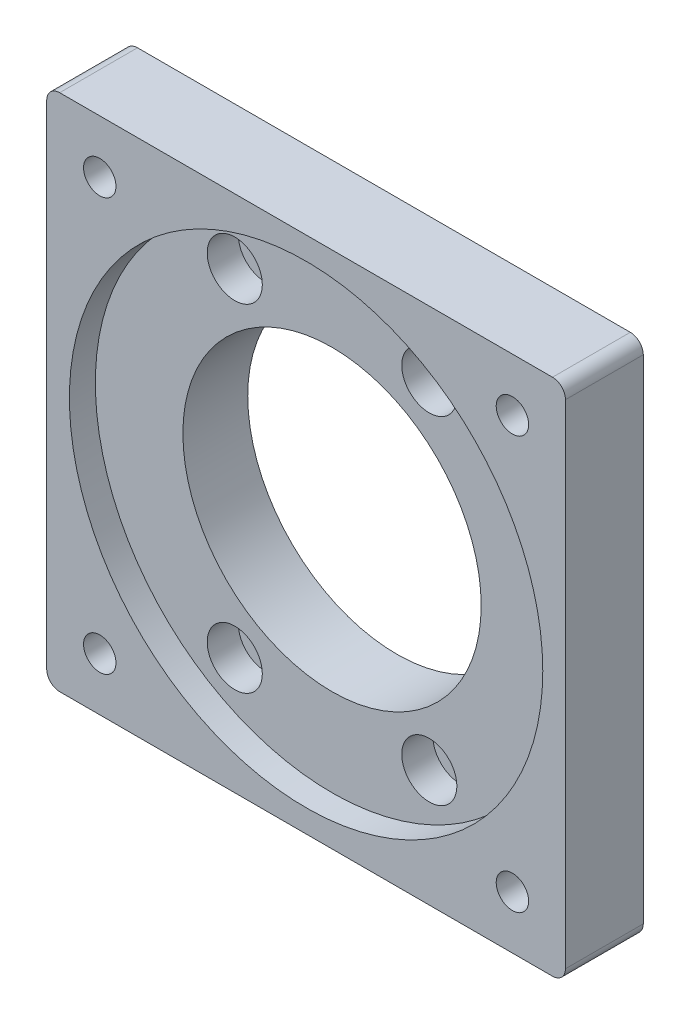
SolidWorks part; units mm, degrees
ref_plane "前视基准面" through (0, 0, 0) normal (0, 0, 1) x (1, 0, 0)
ref_plane "上视基准面" through (0, 0, 0) normal (0, 1, 0) x (1, 0, 0)
ref_plane "右视基准面" through (0, 0, 0) normal (1, 0, 0) x (0, 0, -1)
sketch "草图1" plane through (0, 0, 0) normal (0, 0, 1) x (1, 0, 0)
  line L1 (-40, -40) -> (40, -40)
  line L2 (-40, -40) -> (-40, 40)
  line L3 (-40, 40) -> (40, 40)
  line L4 (40, -40) -> (40, 40)
  line L5 (-40, -40) -> (40, 40) construction
  line L6 (-40, 40) -> (40, -40) construction
  circle A0 centre (0, 0) radius 23
  point P0 (0, 0)
  dimension "D3" = 46
  dimension "D1" = 80
  dimension "D2" = 80
extrude "凸台-拉伸1" add sketch "草图1" along normal blind 12
sketch "草图2" plane through (0, 0, 12) normal (0, 0, 1) x (1, 0, 0)
  line L0 (0, 40) -> (0, 0) construction
  line L1 (40, 40) -> (-40, 40) construction
  line L2 (0, 0) -> (-40, 0) construction
  line L3 (-40, 40) -> (-40, -40) construction
  line L4 (-31.8198, 31.8198) -> (31.8198, -31.8198) construction
  line L5 (31.8198, 31.8198) -> (-31.8198, -31.8198) construction
  circle A0 centre (-31.8198, 31.8198) radius 2.1
  circle A1 centre (31.8198, 31.8198) radius 2.1
  circle A2 centre (31.8198, -31.8198) radius 2.1
  circle A3 centre (-31.8198, -31.8198) radius 2.1
  circle A4 centre (0, 0) radius 45 construction
  dimension "D1" = 45
  dimension "D2" = 90
  dimension "D3" = 4.2
extrude "切除-拉伸1" cut sketch "草图2" against normal through all
sketch "草图3" plane through (0, 0, 12) normal (0, 0, 1) x (1, 0, 0)
  circle A0 centre (0, 0) radius 36.5
  dimension "D1" = 73
extrude "切除-拉伸2" cut sketch "草图3" against normal blind 4
sketch "草图5" plane through (0, 0, 8) normal (0, 0, 1) x (1, 0, 0)
  line L0 (0, 30) -> (0, 0) construction
  line L1 (0, 0) -> (-30, 0) construction
  line L2 (-15, 25.9808) -> (15, -25.9808) construction
  line L3 (15, 25.9808) -> (-15, -25.9808) construction
  circle A0 centre (0, 0) radius 30 construction
  circle A1 centre (-15, 25.9808) radius 2.25
  circle A2 centre (15, 25.9808) radius 2.25
  circle A3 centre (15, -25.9808) radius 2.25
  circle A4 centre (-15, -25.9808) radius 2.25
  dimension "D3" = 60
  dimension "D4" = 4.5
  dimension "D1" = 30
  dimension "D2" = 30
extrude "切除-拉伸3" cut sketch "草图5" against normal through all
sketch "草图6" plane through (0, 0, 8) normal (0, 0, 1) x (1, 0, 0)
  circle A0 centre (-15, 25.9808) radius 4.25
  circle A1 centre (15, 25.9808) radius 4.25
  circle A2 centre (15, -25.9808) radius 4.25
  circle A3 centre (-15, -25.9808) radius 4.25
  dimension "D1" = 8.5
extrude "切除-拉伸4" cut sketch "草图6" against normal blind 4.8
fillet "圆角1" radius 2 4 edges at (-40, 40, 6) (-40, -40, 6) (40, -40, 6) (40, 40, 6)
sketch "草图7" plane through (0, 0, 0) normal (0, 0, -1) x (-1, 0, 0)
  circle A0 centre (0, 0) radius 23 construction
  circle A1 centre (0, 0) radius 23
  circle A2 centre (0, 0) radius 25
  dimension "D1" = 50
extrude "凸台-拉伸2" add sketch "草图7" along normal blind 2
hole_wizard "M6 螺纹孔1" positions "草图8" profile "草图9" tap size "M6" standard "ISO"
sketch "草图8" plane through (0, 0, 12) normal (0, 0, 1) x (1, 0, 0)
  point P0 (-31.8198, 31.8198)
  point P3 (31.8198, 31.8198)
  point P6 (31.8198, -31.8198)
  point P9 (-31.8198, -31.8198)
sketch "草图9" plane through (-31.8198, 31.8198, 12) normal (1, 0, 0) x (0, -1, 0)
  line L0 (0, 0) -> (0, 16.5022)
  line L1 (0, 16.5022) -> (2.5, 15)
  line L2 (2.5, 15) -> (2.5, 0)
  line L5 (2.5, 0) -> (0, 0)
  line L10 (0, 16.5022) -> (-2.5, 15) construction
  line L11 (0, -6.35) -> (0, 107.95) construction
  dimension "螺纹孔钻头直径" = 5
  dimension "螺纹孔钻头深度" = 15
  dimension "导头角度" = 118
